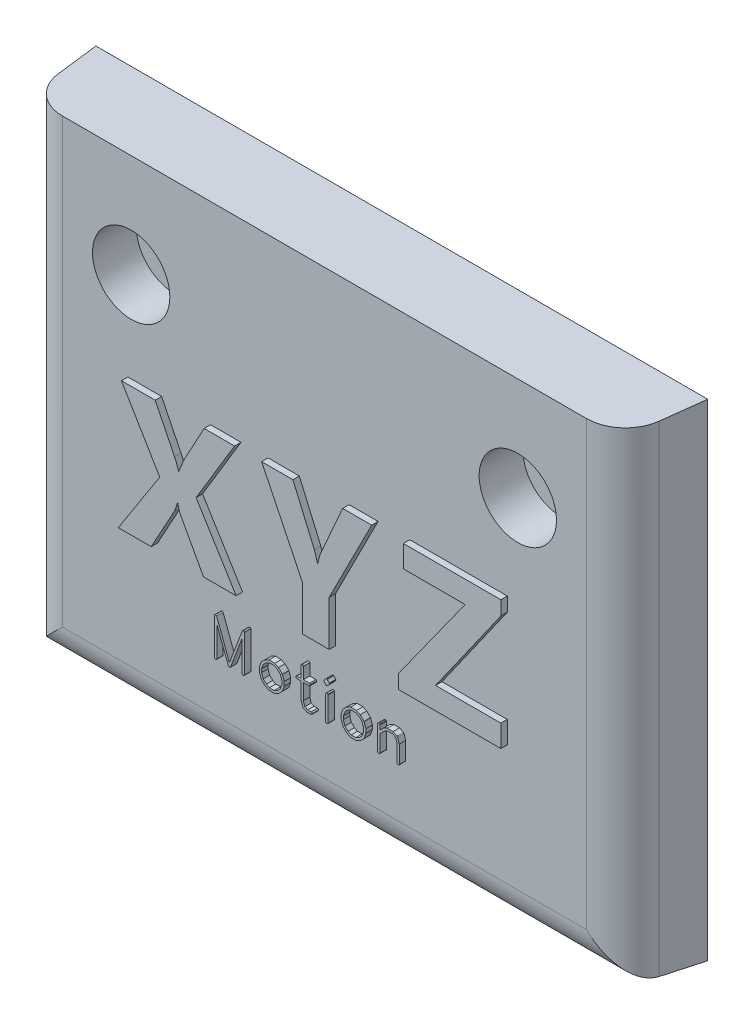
SolidWorks part; units mm, degrees
ref_plane "前视基准面" through (0, 0, 0) normal (0, 0, 1) x (1, 0, 0)
ref_plane "上视基准面" through (0, 0, 0) normal (0, 1, 0) x (1, 0, 0)
ref_plane "右视基准面" through (0, 0, 0) normal (1, 0, 0) x (0, 0, -1)
sketch "草图1" plane through (0, 0, 0) normal (0, 0, 1) x (1, 0, 0)
  line L1 (-23, -18.5) -> (23, -18.5)
  line L2 (-23, -18.5) -> (-23, 18.5)
  line L3 (-23, 18.5) -> (23, 18.5)
  line L4 (23, -18.5) -> (23, 18.5)
  line L5 (-23, -18.5) -> (23, 18.5) construction
  line L6 (-23, 18.5) -> (23, -18.5) construction
  point P0 (0, 0)
  dimension "D1" = 46
  dimension "D2" = 37
extrude "凸台-拉伸1" add sketch "草图1" along normal blind 6
sketch "草图2" plane through (0, 0, 6) normal (0, 0, 1) x (1, 0, 0)
  line L0 (0, 0) -> (0, 50000) construction
  line L2 (23, 18.5) -> (-23, 18.5) construction
  circle A2 centre (-15, 10.5) radius 3
  circle A3 centre (15, 10.5) radius 3
  dimension "D5" = 6
  dimension "D3" = 8
  dimension "D4" = 30
extrude "切除-拉伸1" cut sketch "草图2" against normal blind 3.4
sketch "草图3" plane through (0, 0, 6) normal (0, 0, 1) x (1, 0, 0)
  circle A0 centre (-15, 10.5) radius 1.7
  circle A1 centre (15, 10.5) radius 1.7
  dimension "D1" = 3.4
extrude "切除-拉伸2" cut sketch "草图3" against normal blind 6
draft "拔模1" type of draft neutral plane draft angle 7 faces to draft 1 parameters "D1"=7
draft "拔模2" type of draft neutral plane draft angle 7 faces to draft 1 parameters "D1"=7
draft "拔模4" type of draft neutral plane draft angle 7 faces to draft 1 parameters "D1"=7
shell "抽壳1" thickness 1.5
fillet "圆角1" radius 1.5 5 edges at (-21.9492, -17.4492, 2.25) (-21.6729, -0.0865, 4.5) (21.9492, -17.4492, 2.25) (21.6729, -0.0865, 4.5) (0, -17.1729, 4.5)
fillet "圆角2" radius 3 5 edges at (23, 0, 6) (0, -18.5, 6) (23.3684, -18.8684, 3) (-23.3684, -18.8684, 3) (-23, 0, 6)
sketch "草图5" plane through (0, 0, 0) normal (0, 0, -1) x (-1, 0, 0)
  line L21 (-20.7366, -18.3254) -> (20.7366, -18.3254)
  line L22 (22.8254, -16.2366) -> (22.8254, 17.6)
  line L23 (22.8254, 17.6) -> (-22.8254, 17.6)
  line L24 (-22.8254, 17.6) -> (-22.8254, -16.2366)
  line L25 (-20.7366, -18.3254) -> (20.7366, -18.3254)
  line L26 (22.8254, -16.2366) -> (22.8254, 17.6)
  line L27 (22.8254, 17.6) -> (-22.8254, 17.6)
  line L28 (-22.8254, 17.6) -> (-22.8254, -16.2366)
  spline S0 degree 3 poles (2922.9209, 549.6611) (304.4019, 83.3094) (-27.0276, 4.8665) (-22.7594, -16.7773) (-22.7195, -16.91) (-22.6151, -17.1631) (-22.5512, -17.2832) (-22.4, -17.5104) (-22.3119, -17.618) (-22.0229, -17.9072) (-21.7898, -18.0626) (-8.4818, -23.5636) (66.1673, 103.215) (-2764.3767, 1186.9221) knots -20.014941 -20.014941 -20.014941 -20.014941 0.125 0.125 0.25 0.25 0.375 0.375 0.5 0.5 0.75 0.75 13.73101 13.73101 13.73101 13.73101 only from (-22.8254, -16.2366) to (-20.7366, -18.3254)
  spline S1 degree 3 poles (-545.1611, 2927.4209) (-78.8094, 308.9019) (-0.3665, -22.5276) (21.2773, -18.2594) (21.41, -18.2195) (21.6631, -18.1151) (21.7832, -18.0512) (22.0104, -17.9) (22.118, -17.8119) (22.4072, -17.5229) (22.5626, -17.2898) (28.0636, -3.9818) (-98.715, 70.6673) (-1182.4221, -2759.8767) knots -20.014941 -20.014941 -20.014941 -20.014941 0.125 0.125 0.25 0.25 0.375 0.375 0.5 0.5 0.75 0.75 13.73101 13.73101 13.73101 13.73101 only from (20.7366, -18.3254) to (22.8254, -16.2366)
  spline S2 degree 3 poles (-22.8254, -16.2366) (-22.8254, -16.3746) (-22.812, -16.5103) (-22.7594, -16.7773) (-22.7195, -16.91) (-22.6151, -17.1631) (-22.5512, -17.2832) (-22.4, -17.5104) (-22.3119, -17.618) (-22.0229, -17.9072) (-21.7898, -18.0626) (-21.2869, -18.2705) (-21.0126, -18.3254) (-20.7366, -18.3254) knots 0 0 0 0 0.125 0.125 0.25 0.25 0.375 0.375 0.5 0.5 0.75 0.75 1 1 1 1
  spline S3 degree 3 poles (20.7366, -18.3254) (20.8746, -18.3254) (21.0103, -18.312) (21.2773, -18.2594) (21.41, -18.2195) (21.6631, -18.1151) (21.7832, -18.0512) (22.0104, -17.9) (22.118, -17.8119) (22.4072, -17.5229) (22.5626, -17.2898) (22.7705, -16.7869) (22.8254, -16.5126) (22.8254, -16.2366) knots 0 0 0 0 0.125 0.125 0.25 0.25 0.375 0.375 0.5 0.5 0.75 0.75 1 1 1 1
  dimension "D1" = 0.6
extrude "切除-拉伸3" cut sketch "草图5" against normal blind 0.2
sketch "草图6" plane through (0, 0, 6) normal (0, 0, 1) x (1, 0, 0)
  line L0 (0, -23.5828) -> (0, 27.6797) construction
  line L1 (-15.5, -6.5) -> (14.5, -6.5) construction
  line L3 (-8, -11.5) -> (12, -11.5) construction
  line L4 (20.3458, 18.5) -> (-20.3458, 18.5) construction
  text T0 "XYZ" font "微软雅黑" height 10
  text T1 "Motion" font "SWSimp" height 3
  dimension "D1" = 30
  dimension "D2" = 20
  dimension "D3" = 25
  dimension "D4" = 30
  dimension "D5" = 15.5
  dimension "D6" = 8
extrude "凸台-拉伸2" add sketch "草图6" along normal blind 0.5
